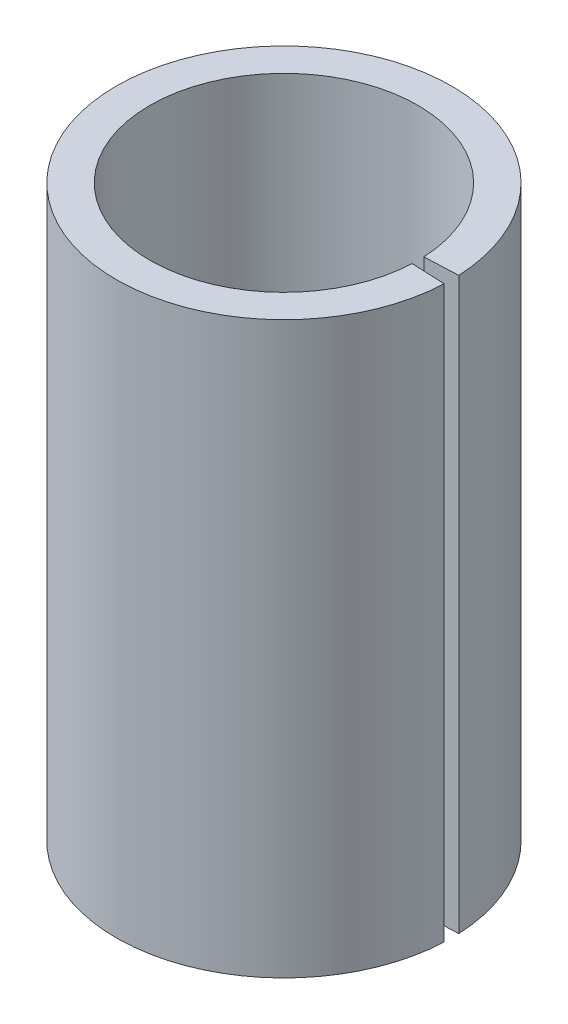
SolidWorks part; units mm, degrees
ref_plane "Front Plane" through (0, 0, 0) normal (0, 0, 1) x (1, 0, 0)
ref_plane "Top Plane" through (0, 0, 0) normal (0, 1, 0) x (1, 0, 0)
ref_plane "Right Plane" through (0, 0, 0) normal (1, 0, 0) x (0, 0, -1)
sketch "Sketch1" plane through (0, 0, 0) normal (0, 1, 0) x (1, 0, 0)
  line L0 (2.5376, -0.1108) -> (2.0301, -0.0886)
  line L1 (2.5376, 0.1108) -> (2.0301, 0.0886)
  line L2 (-2.794, 0) -> (2.794, 0) construction
  arc A0 (2.5376, 0.1108) -> (2.5376, -0.1108) centre (0, 0) ccw
  arc A1 (2.0301, 0.0886) -> (2.0301, -0.0886) centre (0, 0) ccw
  dimension "D2" = 0.508
  dimension "D3" = 2.54
  dimension "D1" = 5
  dimension "D4" = 2.5
extrude "Extrude1" add sketch "Sketch1" along normal blind 8.636
